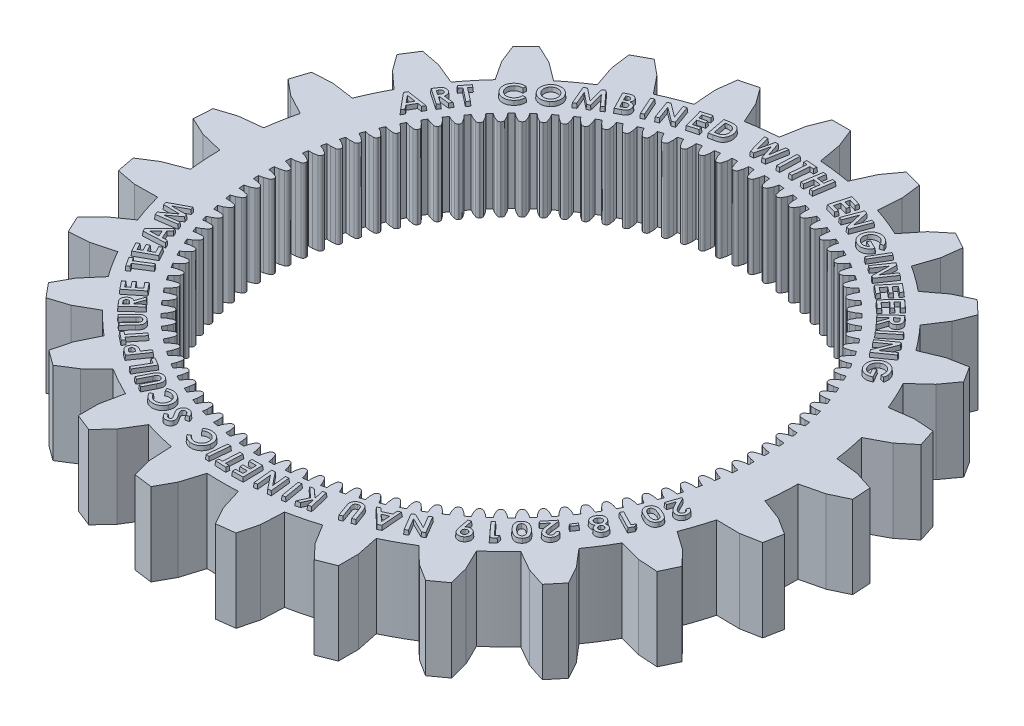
SolidWorks part; units mm, degrees
ref_plane "Front Plane" through (0, 0, 0) normal (0, 0, 1) x (1, 0, 0)
ref_plane "Top Plane" through (0, 0, 0) normal (0, 1, 0) x (1, 0, 0)
ref_plane "Right Plane" through (0, 0, 0) normal (1, 0, 0) x (0, 0, -1)
sketch "Sketch1" plane through (0, 0, 0) normal (0, 1, 0) x (1, 0, 0)
  circle A0 centre (0, 0) radius 177.8
  circle A1 centre (0, 0) radius 152.4
  dimension "D1" = 355.6
  dimension "D2" = 304.8
extrude "Boss-Extrude1" add sketch "Sketch1" along normal blind 50.8
sketch "Sketch3" plane through (0, 50.8, 0) normal (0, 1, 0) x (1, 0, 0)
  circle A0 centre (0, 0) radius 158.75 construction
  circle A1 centre (0, 0) radius 152.4 construction
  text T0 "<b>      2018-2019 NAU KINETIC SCULPTURE TEAM                 ART COMBINED WITH ENGINEERING           </b>  " font "Century Gothic" height 12.7
  dimension "D1" = 317.5
sketch "Sketch5" plane through (0, 50.8, 0) normal (0, 1, 0) x (1, 0, 0)
  line L0 (-12.7, 177.3458) -> (12.7, 177.3458)
  line L1 (12.7, 177.3458) -> (10.2367, 191.3158)
  line L2 (10.2367, 191.3158) -> (5.715, 202.7458)
  line L3 (5.715, 202.7458) -> (-5.715, 202.7458)
  line L4 (-5.715, 202.7458) -> (-10.2367, 191.3158)
  line L5 (-10.2367, 191.3158) -> (-12.7, 177.3458)
  circle A0 centre (0, 0) radius 177.8 construction
  dimension "D1" = 25.4
  dimension "D2" = 13.97
  dimension "D3" = 80
  dimension "D4" = 80
  dimension "D5" = 25.4
  dimension "D6" = 11.43
extrude "Boss-Extrude2" add sketch "Sketch5" against normal blind 50.8
pattern_circular "CirPattern1" count 25 over 360 about axis through (0, 0, 0) along (0, 1, 0) of "Boss-Extrude2"
sketch "Sketch6" plane through (0, 50.8, 0) normal (0, 1, 0) x (1, 0, 0)
  line L0 (152.3669, 3.175) -> (149.8269, 2.7271)
  line L1 (149.8269, 2.7271) -> (146.0169, 1.3404)
  line L2 (146.0169, 1.3404) -> (146.0169, -1.3404)
  line L3 (146.0169, -1.3404) -> (149.8269, -2.7271)
  line L4 (149.8269, -2.7271) -> (152.3669, -3.175)
  line L5 (152.3669, -3.175) -> (156.3067, 2.0543)
  line L6 (156.3067, 2.0543) -> (152.3669, 3.175)
  line L7 (152.3669, 3.175) -> (152.3669, -3.175) construction
  circle A0 centre (0, 0) radius 152.4 construction
  dimension "D1" = 80
  dimension "D2" = 80
  dimension "D3" = 2.54
  dimension "D4" = 3.81
  dimension "D5" = 6.35
  dimension "D6" = 110
  dimension "D7" = 110
extrude "Boss-Extrude3" add sketch "Sketch6" against normal blind 50.8
fillet "Fillet1" radius 1.778 2 edges at (146.0169, 25.4, -1.3404) (146.0169, 25.4, 1.3404)
pattern_circular "CirPattern2" count 100 over 360 about axis through (0, 0, 0) along (0, 1, 0) of "Boss-Extrude3", "Fillet1"
extrude "Boss-Extrude4" add sketch "Sketch3" along normal blind 2.54 draft 5
sketch "Sketch7" plane through (0, 50.8, 0) normal (0, 1, 0) x (1, 0, 0)
  line L0 (284.0871, -26.9522) -> (0, 0) construction
  line L5 (0, 0) -> (-242.4797, 213.922) construction
  line L6 (0, 0) -> (-308.8198, -182.493) construction
  line L8 (0, 0) -> (116.3187, 268.5447) construction
  line L10 (0, 0) -> (85.3757, -296.171) construction
  line L12 (-110.1333, -433.5087) -> (-308.8198, 196.6109)
  line L21 (-308.8198, 196.6109) -> (116.3187, 268.5447)
  line L23 (0, 0) -> (227.0625, 174.738)
  line L24 (-110.1333, -433.5087) -> (545.5018, -145.8201)
  line L25 (0, 0) -> (252.849, 40.4112)
  line L26 (545.5018, -145.8201) -> (252.849, 40.4112)
  line L27 (116.3187, 268.5447) -> (227.0625, 174.738)
  dimension "D1" = 72
  dimension "D2" = 72
  dimension "D3" = 75.5
  dimension "D4" = 72
  dimension "D5" = 29
  dimension "D6" = 28.5
